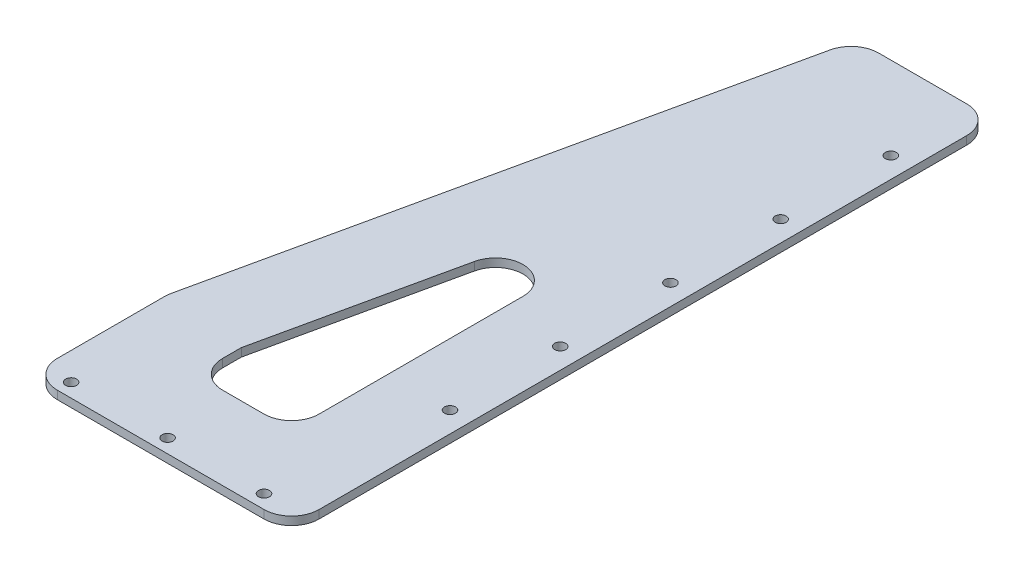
SolidWorks part; units mm, degrees
ref_plane "Front" through (0, 0, 0) normal (0, 0, 1) x (1, 0, 0)
ref_plane "Top" through (0, 0, 0) normal (0, 1, 0) x (1, 0, 0)
ref_plane "Right" through (0, 0, 0) normal (1, 0, 0) x (0, 0, -1)
sketch "草图1" plane through (0, 0, 0) normal (0, 1, 0) x (1, 0, 0)
  line L0 (0, 0) -> (95, 0)
  line L1 (30, 30) -> (65, 30)
  line L2 (45, 255) -> (95, 255)
  line L3 (65, 30) -> (65, 91.4921)
  line L4 (65, 91.4921) -> (65, 206.1905)
  line L5 (65, 206.1905) -> (65, 206.1905)
  line L6 (30, 46.7461) -> (65, 206.1905)
  line L7 (30, 30) -> (30, 46.7461)
  line L8 (0, 0) -> (0, 50)
  line L9 (0, 50) -> (45, 255)
  line L10 (95, 255) -> (95, 0)
  line L12 (95, 91.4921) -> (95, 255) construction
  line L13 (95, 0) -> (95, 91.4921) construction
  dimension "D1" = 95
  dimension "D2" = 255
  dimension "D3" = 45
  dimension "D4" = 50
  dimension "D6" = 50
  dimension "D5" = 30
extrude "凸台-拉伸1" add sketch "草图1" along normal blind 3
sketch "草图2" plane through (0, 3, 0) normal (0, 1, 0) x (1, 0, 0)
  line L0 (0, 0) -> (95, 0) construction
  line L1 (0, 50) -> (0, 0) construction
  line L2 (95, 0) -> (95, 255) construction
  line L3 (95, 255) -> (45, 255) construction
  circle A0 centre (10, 5) radius 2
  circle A1 centre (45, 5) radius 2
  circle A2 centre (80, 5) radius 2
  circle A3 centre (87.5, 225) radius 2
  circle A4 centre (87.5, 185) radius 2
  circle A5 centre (87.5, 145) radius 2
  circle A6 centre (87.5, 105) radius 2
  circle A7 centre (87.5, 65) radius 2
  dimension "D2" = 4
  dimension "D5" = 4
  dimension "D6" = 7.5
  dimension "D7" = 30
  dimension "D1" = 5
  dimension "D3" = 10
  dimension "D4" = 3
  dimension "D8" = 5
extrude "切除-拉伸1" cut sketch "草图2" against normal up to next
sketch "草图3" plane through (0, 3, 0) normal (0, 1, 0) x (1, 0, 0)
  line L0 (8, 5) -> (12, 5) construction
  line L1 (8, 7.2) -> (12, 7.2)
  line L2 (8, 2.8) -> (12, 2.8)
  line L3 (43, 5) -> (47, 5) construction
  line L4 (43, 7.2) -> (47, 7.2)
  line L5 (43, 2.8) -> (47, 2.8)
  line L6 (78, 5) -> (82, 5) construction
  line L7 (78, 7.2) -> (82, 7.2)
  line L8 (78, 2.8) -> (82, 2.8)
  line L9 (87.5, 227) -> (87.5, 223) construction
  line L10 (89.7, 227) -> (89.7, 223)
  line L11 (85.3, 227) -> (85.3, 223)
  line L12 (87.5, 187) -> (87.5, 183) construction
  line L13 (89.7, 187) -> (89.7, 183)
  line L14 (85.3, 187) -> (85.3, 183)
  line L15 (87.5, 147) -> (87.5, 143) construction
  line L16 (89.7, 147) -> (89.7, 143)
  line L17 (85.3, 147) -> (85.3, 143)
  line L18 (87.5, 107) -> (87.5, 103) construction
  line L19 (89.7, 107) -> (89.7, 103)
  line L20 (85.3, 107) -> (85.3, 103)
  line L21 (87.5, 67) -> (87.5, 63) construction
  line L22 (89.7, 67) -> (89.7, 63)
  line L23 (85.3, 67) -> (85.3, 63)
  circle A0 centre (10, 5) radius 2 construction
  arc A1 (8, 7.2) -> (8, 2.8) centre (8, 5) ccw
  arc A2 (12, 2.8) -> (12, 7.2) centre (12, 5) ccw
  circle A3 centre (45, 5) radius 2 construction
  arc A4 (43, 7.2) -> (43, 2.8) centre (43, 5) ccw
  arc A5 (47, 2.8) -> (47, 7.2) centre (47, 5) ccw
  circle A6 centre (80, 5) radius 2 construction
  arc A7 (78, 7.2) -> (78, 2.8) centre (78, 5) ccw
  arc A8 (82, 2.8) -> (82, 7.2) centre (82, 5) ccw
  circle A9 centre (87.5, 225) radius 2 construction
  arc A10 (89.7, 227) -> (85.3, 227) centre (87.5, 227) ccw
  arc A11 (85.3, 223) -> (89.7, 223) centre (87.5, 223) ccw
  circle A12 centre (87.5, 185) radius 2 construction
  arc A13 (89.7, 187) -> (85.3, 187) centre (87.5, 187) ccw
  arc A14 (85.3, 183) -> (89.7, 183) centre (87.5, 183) ccw
  circle A15 centre (87.5, 145) radius 2 construction
  arc A16 (89.7, 147) -> (85.3, 147) centre (87.5, 147) ccw
  arc A17 (85.3, 143) -> (89.7, 143) centre (87.5, 143) ccw
  circle A18 centre (87.5, 105) radius 2 construction
  arc A19 (89.7, 107) -> (85.3, 107) centre (87.5, 107) ccw
  arc A20 (85.3, 103) -> (89.7, 103) centre (87.5, 103) ccw
  circle A21 centre (87.5, 65) radius 2 construction
  arc A22 (89.7, 67) -> (85.3, 67) centre (87.5, 67) ccw
  arc A23 (85.3, 63) -> (89.7, 63) centre (87.5, 63) ccw
  point P4 (10, 5)
  point P14 (45, 5)
  point P19 (80, 5)
  point P34 (87.5, 225)
  point P44 (87.5, 185)
  point P54 (87.5, 145)
  point P64 (87.5, 105)
  point P74 (87.5, 65)
  dimension "D1" = 2.2
  dimension "D2" = 2.2
  dimension "D3" = 2.2
  dimension "D4" = 2.2
  dimension "D5" = 2.2
  dimension "D6" = 2.2
  dimension "D7" = 2.2
  dimension "D8" = 2.2
extrude "切除-拉伸2" [suppressed] cut sketch "草图3" against normal up to next
fillet "圆角1" radius 10 8 edges at (65, 1.5, -30) (30, 1.5, -30) (0, 1.5, -50) (0, 1.5, 0) (95, 1.5, 0) (95, 1.5, -255) (45, 1.5, -255) (65, 1.5, -206.1905)
